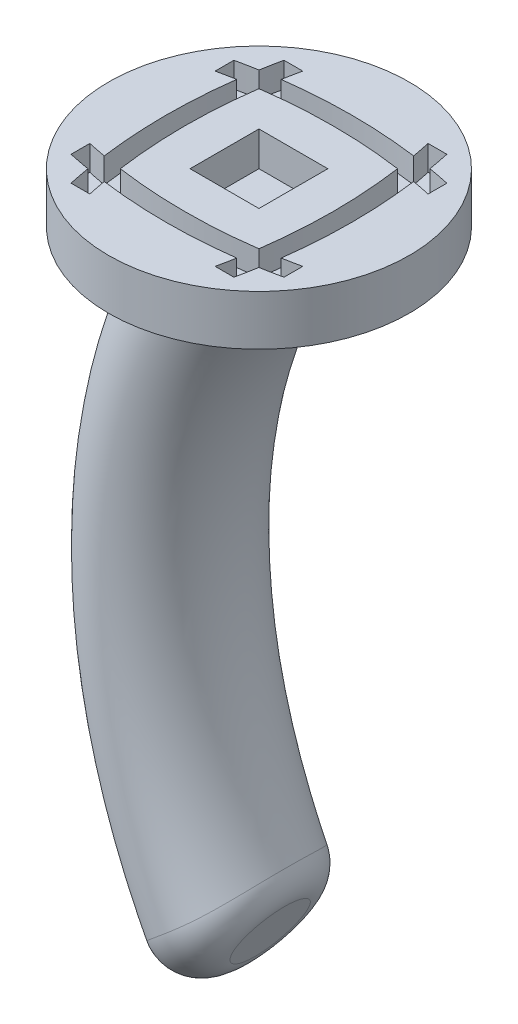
SolidWorks part; units mm, degrees
ref_plane "Front Plane" through (0, 0, 0) normal (0, 0, 1) x (1, 0, 0)
ref_plane "Top Plane" through (0, 0, 0) normal (0, 1, 0) x (1, 0, 0)
ref_plane "Right Plane" through (0, 0, 0) normal (1, 0, 0) x (0, 0, -1)
sketch "Sketch1" plane through (0, 0, 0) normal (0, 1, 0) x (1, 0, 0)
  circle A0 centre (0, 0) radius 24
  dimension "D1" = 48
extrude "Boss-Extrude1" add sketch "Sketch1" along normal blind 8
sketch "Sketch3" plane through (0, 8, 0) normal (0, 1, 0) x (1, 0, 0)
  line L0 (-5.5, 5.5) -> (5.5, 5.5)
  line L1 (5.5, 5.5) -> (5.5, -5.5)
  line L2 (5.5, -5.5) -> (-5.5, -5.5)
  line L3 (-5.5, -5.5) -> (-5.5, 5.5)
  dimension "D1" = 11
  dimension "D2" = 5.5
  dimension "D3" = 11
  dimension "D4" = 5.5
extrude "Cut-Extrude2" cut sketch "Sketch3" against normal blind 5.5
ref_plane "Plane1" through (0, -30, 0) normal (0, -1, 0) x (-1, 0, 0)
ref_plane "Plane2" through (0, -100, 0) normal (0, -1, 0) x (-1, 0, 0)
sketch "Sketch5" plane through (0, 0, 0) normal (0, -1, 0) x (1, 0, 0)
  circle A0 centre (0, 0) radius 12
  dimension "D1" = 24
sketch "Sketch6" plane through (0, -30, 0) normal (0, -1, 0) x (-1, 0, 0)
  circle A0 centre (12, 0) radius 12
  dimension "D1" = 24
  dimension "D2" = 12
sketch "Sketch7" plane through (0, -100, 0) normal (0, -1, 0) x (-1, 0, 0)
  circle A0 centre (0, 0) radius 12
sketch "Sketch8" plane through (0, 0, 0) normal (0, 0, 1) x (1, 0, 0)
  line L2 (-24, 0) -> (24, 0) construction
  line L3 (-12, -100) -> (12, -100) construction
  arc A0 (0, 0) -> (0, -100) centre (81.575, -50) ccw
sweep "Sweep1" add profiles "Sketch5" path "Sketch8"
fillet "Fillet4" radius 6 1 edges at (0, -100, -12)
sketch "Sketch9" plane through (0, 8, 0) normal (0, 1, 0) x (1, 0, 0)
  line L0 (-17, 13) -> (-17, 10)
  line L1 (17, 13) -> (17, 10)
  line L2 (13, 17) -> (10, 17)
  line L3 (13, -17) -> (10, -17)
  line L4 (17, -13) -> (17, -10)
  line L5 (-17, -13) -> (-17, -10)
  line L6 (-13, -17) -> (-10, -17)
  line L7 (-13, 17) -> (-10, 17)
  arc A0 (-17, 13) -> (-13.6534, 13.6534) centre (0, -65.1729) cw
  arc A1 (-17, 10) -> (-14.125, 10.5759) centre (0, -67.4052) cw
  arc A2 (13, 17) -> (13.6534, 13.6534) centre (-65.1729, 0) cw
  arc A3 (10, 17) -> (10.5759, 14.125) centre (-67.4052, 0) cw
  arc A4 (17, -13) -> (13.6534, -13.6534) centre (0, 65.1729) cw
  arc A5 (17, -10) -> (14.125, -10.5759) centre (0, 67.4052) cw
  arc A6 (-13, -17) -> (-13.6534, -13.6534) centre (65.1729, 0) cw
  arc A7 (-10, -17) -> (-10.5759, -14.125) centre (67.4052, 0) cw
  arc A8 (-10.5759, 14.125) -> (10.5759, 14.125) centre (0, -65.1729) cw
  arc A9 (-13.6534, 13.6534) -> (-13, 17) centre (65.1729, 0) cw
  arc A10 (-10.5759, 14.125) -> (-10, 17) centre (67.4052, 0) cw
  arc A11 (-11.0681, 11.0681) -> (11.0681, 11.0681) centre (0, -67.4052) cw
  arc A12 (14.125, 10.5759) -> (17, 10) centre (0, -67.4052) cw
  arc A13 (13.6534, 13.6534) -> (17, 13) centre (0, -65.1729) cw
  arc A14 (11.0681, 11.0681) -> (11.0681, -11.0681) centre (-67.4052, 0) cw
  arc A15 (14.125, 10.5759) -> (14.125, -10.5759) centre (-65.1729, 0) cw
  arc A16 (11.0681, -11.0681) -> (-11.0681, -11.0681) centre (0, 67.4052) cw
  arc A17 (10.5759, -14.125) -> (-10.5759, -14.125) centre (0, 65.1729) cw
  arc A18 (13.6534, -13.6534) -> (13, -17) centre (-65.1729, 0) cw
  arc A19 (10.5759, -14.125) -> (10, -17) centre (-67.4052, 0) cw
  arc A20 (-11.0681, -11.0681) -> (-11.0681, 11.0681) centre (67.4052, 0) cw
  arc A21 (-14.125, -10.5759) -> (-14.125, 10.5759) centre (65.1729, 0) cw
  arc A22 (-14.125, -10.5759) -> (-17, -10) centre (0, 67.4052) cw
  arc A23 (-13.6534, -13.6534) -> (-17, -13) centre (0, 65.1729) cw
  point P28 (0, 0)
  dimension "D7" = 80
  dimension "D8" = 79.25
  dimension "D1" = 17
  dimension "D2" = 34
  dimension "D3" = 3
  dimension "D4" = 3
  dimension "D5" = 10
  dimension "D6" = 10
  dimension "D9" = 4
extrude "Cut-Extrude3" cut sketch "Sketch9" against normal blind 4
